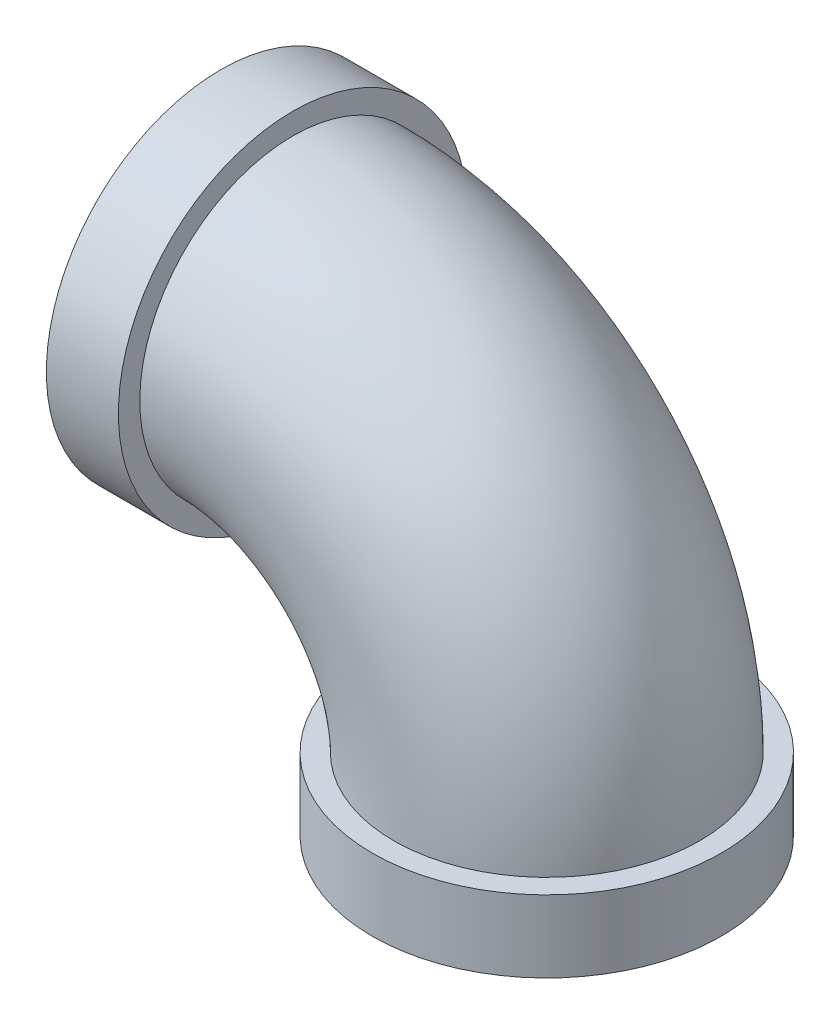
SolidWorks part; units mm, degrees
ref_plane "Front Plane" through (0, 0, 0) normal (0, 0, 1) x (1, 0, 0)
ref_plane "Top Plane" through (0, 0, 0) normal (0, 1, 0) x (1, 0, 0)
ref_plane "Right Plane" through (0, 0, 0) normal (1, 0, 0) x (0, 0, -1)
sketch "ElbowArc" plane through (0, 0, 0) normal (0, 0, 1) x (1, 0, 0)
  line L0 (0, 0) -> (31.0619, 0) construction
  line L1 (0, 0) -> (0, 30.686) construction
  arc A0 (22.1234, 0) -> (0, 22.1234) centre (0, 0) ccw
  dimension "BendRadius" = 22.1234
  dimension "BendAngle" = 90
sketch "Sketch2" plane through (0, 0, 0) normal (0, 1, 0) x (1, 0, 0)
  circle A0 centre (22.1234, 0) radius 13.335
  circle A1 centre (22.1234, 0) radius 7.62
  dimension "Diameter" = 26.67
  dimension "ID" = 15.24
sweep "Sweep1" add profiles "Sketch2" path "ElbowArc"
sketch "Sketch3" plane through (0, 0, 0) normal (0, -1, 0) x (1, 0, 0)
  circle A0 centre (22.1234, 0) radius 15.2019
  circle A1 centre (22.1234, 0) radius 13.335 construction
extrude "Boss-Extrude1" add sketch "Sketch3" along normal blind 6.2738
sketch "Sketch4" plane through (0, -6.2738, 0) normal (0, -1, 0) x (1, 0, 0)
  circle A0 centre (22.1234, 0) radius 11.0998
  circle A1 centre (22.1234, 0) radius 15.2019 construction
extrude "Cut-Extrude1" cut sketch "Sketch4" against normal up to surface (6.2738 mm away)
sketch "Sketch5" plane through (0, 0, 0) normal (-1, 0, 0) x (0, -1, 0)
  circle A0 centre (-22.1234, 0) radius 15.2019
  circle A2 centre (-22.1234, 0) radius 13.335 construction
extrude "Boss-Extrude2" add sketch "Sketch5" along normal blind 6.2738
sketch "Sketch6" plane through (-6.2738, 0, 0) normal (-1, 0, 0) x (0, -1, 0)
  circle A0 centre (-22.1234, 0) radius 11.0998
  circle A2 centre (-22.1234, 0) radius 15.2019 construction
extrude "Cut-Extrude2" cut sketch "Sketch6" against normal up to surface (6.2738 mm away)
